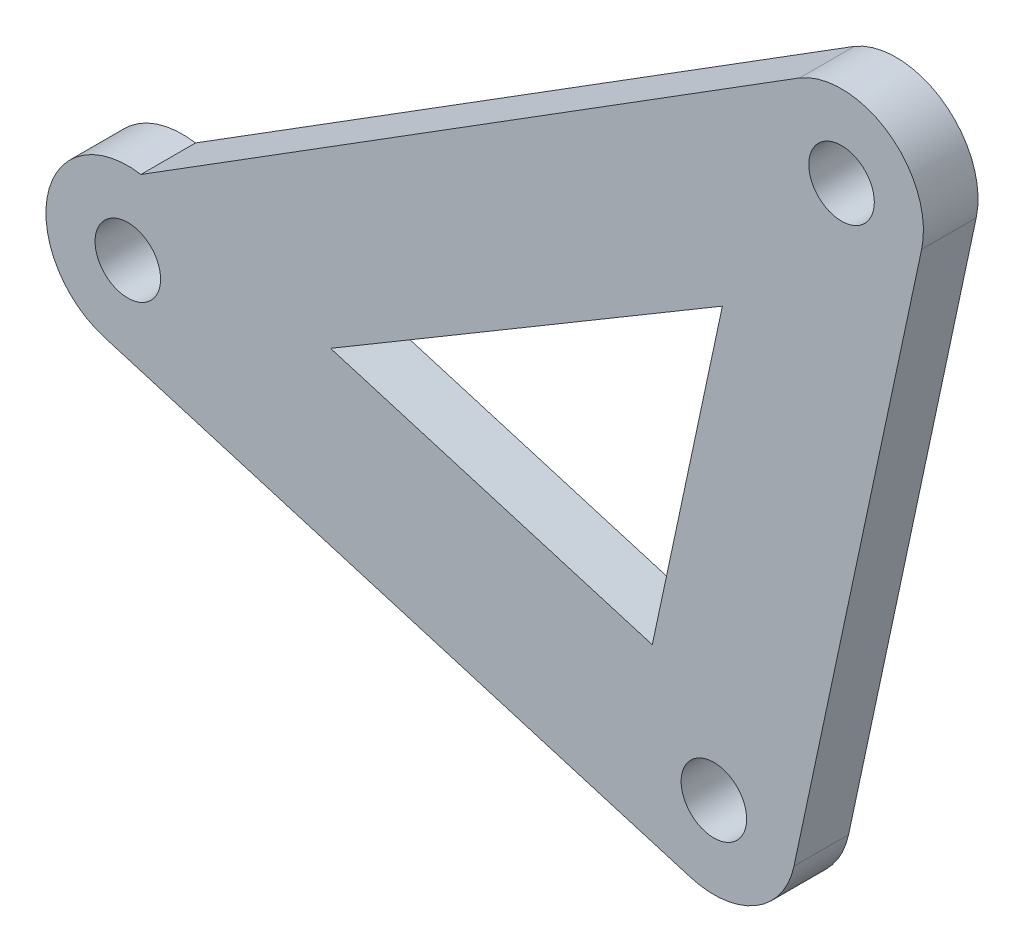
SolidWorks part; units mm, degrees
ref_plane "Plan de face" through (0, 0, 0) normal (0, 0, 1) x (1, 0, 0)
ref_plane "Plan de dessus" through (0, 0, 0) normal (0, 1, 0) x (1, 0, 0)
ref_plane "Plan de droite" through (0, 0, 0) normal (1, 0, 0) x (0, 0, -1)
sketch "Esquisse1" plane through (0, 0, 0) normal (0, 0, 1) x (1, 0, 0)
  line L0 (-117.6698, 11.9859) -> (-64, -4) construction
  line L1 (-115.5289, 19.1738) -> (-61.859, 3.1879)
  line L2 (-119.8108, 4.7979) -> (-66.141, -11.1879)
  line L3 (-64, -4) -> (-52.3085, 50.7659) construction
  line L4 (-71.3347, -2.4342) -> (-59.6432, 52.3318)
  line L5 (-56.6653, -5.5658) -> (-44.9738, 49.2001)
  line L6 (-52.3085, 50.7659) -> (-117.6698, 11.9859) construction
  line L7 (-48.4815, 44.3158) -> (-113.8429, 5.5357)
  line L8 (-56.1355, 57.2161) -> (-121.4968, 18.436)
  line L9 (-99.1029, 14.2812) -> (-63.2215, 35.5703)
  line L10 (-63.2215, 35.5703) -> (-69.6398, 5.5055)
  line L11 (-69.6398, 5.5055) -> (-99.1029, 14.2812)
  line L12 (-119.8108, 4.7979) -> (-66.141, -11.1879)
  line L13 (-44.9738, 49.2001) -> (-56.6653, -5.5658)
  line L14 (-56.1355, 57.2161) -> (-122.5274, 15.591)
  arc A0 (-115.5289, 19.1738) -> (-119.8108, 4.7979) centre (-117.6698, 11.9859) ccw
  arc A1 (-66.141, -11.1879) -> (-61.859, 3.1879) centre (-64, -4) ccw
  arc A2 (-71.3347, -2.4342) -> (-56.6653, -5.5658) centre (-64, -4) ccw
  arc A3 (-44.9738, 49.2001) -> (-59.6432, 52.3318) centre (-52.3085, 50.7659) ccw
  arc A4 (-48.4815, 44.3158) -> (-56.1355, 57.2161) centre (-52.3085, 50.7659) ccw
  arc A5 (-121.4968, 18.436) -> (-113.8429, 5.5357) centre (-117.6698, 11.9859) ccw
  point P4 (-90.8349, 3.9929)
  point P9 (-58.1543, 23.383)
  point P17 (-84.9892, 31.3759)
  point P24 (-63.2215, 35.5703)
  point P25 (-69.6398, 5.5055)
  point P26 (-99.1029, 14.2812)
  dimension "D1" = 15
  dimension "D2" = 15
  dimension "D3" = 15
extrude "Boss.-Extru.1" add sketch "Esquisse1" against normal blind 5 contours A3 L8 A0 L1 L7 L4 | L7 A4 A3 L4 | A4 L7 L4 L1 A1 L5 | L4 A2 A1 L1 | A5 L2 A2 L4 L1 L7 | A0 A5 L7 L1
sketch "Esquisse2" plane through (0, 0, 0) normal (0, 0, 1) x (1, 0, 0)
  circle A0 centre (-117.6698, 11.9859) radius 3
  circle A1 centre (-64, -4) radius 3
  circle A2 centre (-52.3085, 50.7659) radius 3
  dimension "D1" = 6
  dimension "D2" = 6
  dimension "D3" = 6
extrude "Enlèv. mat.-Extru.1" cut sketch "Esquisse2" against normal through all both contours A0 | A1 | A2
